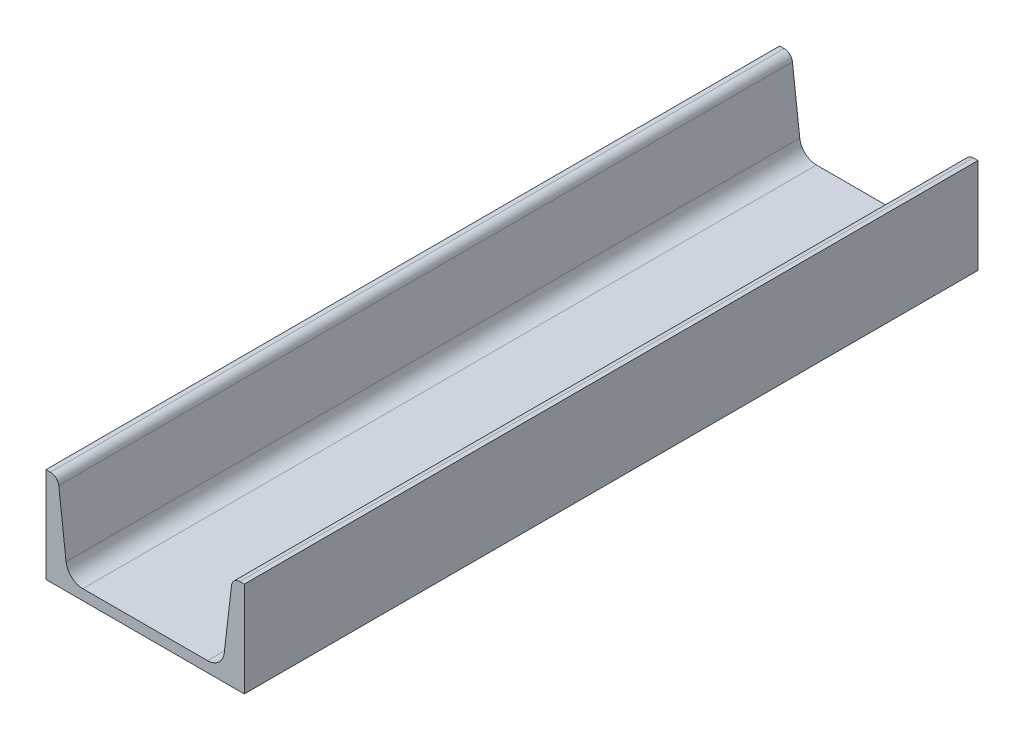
SolidWorks part; units mm, degrees
ref_plane "前视基准面" through (0, 0, 0) normal (0, 0, 1) x (1, 0, 0)
ref_plane "上视基准面" through (0, 0, 0) normal (0, 1, 0) x (1, 0, 0)
ref_plane "右视基准面" through (0, 0, 0) normal (1, 0, 0) x (0, 0, -1)
sketch "草图1" plane through (0, 0, 0) normal (0, 0, 1) x (1, 0, 0)
  line L0 (-50, 0) -> (50, 0)
  line L1 (50, 0) -> (50, 48)
  line L2 (50, 48) -> (47.7369, 48)
  line L3 (43.5654, 44.2885) -> (39.8796, 12.8114)
  line L4 (31.4372, 5.3) -> (-31.4372, 5.3)
  line L5 (-39.8796, 12.8114) -> (-43.5654, 44.2885)
  line L6 (-47.7369, 48) -> (-50, 48)
  line L7 (-50, 48) -> (-50, 0)
  line L8 (-50, 26.65) -> (-41.5, 26.65) construction
  line L9 (41.5, 26.65) -> (50, 26.65) construction
  arc A0 (-31.4372, 5.3) -> (-39.8796, 12.8114) centre (-31.4372, 13.8) cw
  arc A1 (39.8796, 12.8114) -> (31.4372, 5.3) centre (31.4372, 13.8) cw
  arc A2 (-43.5654, 44.2885) -> (-47.7369, 48) centre (-47.7369, 43.8) ccw
  arc A3 (47.7369, 48) -> (43.5654, 44.2885) centre (47.7369, 43.8) ccw
  point P19 (-44, 48)
  point P22 (44, 48)
  dimension "D10" = 8.5
  dimension "D11" = 4.2
  dimension "D1" = 100
  dimension "D2" = 6
  dimension "D3" = 6
  dimension "D4" = 48
  dimension "D5" = 48
  dimension "D6" = 5.3
  dimension "D7" = 21.35
  dimension "D8" = 8.5
  dimension "D9" = 8.5
extrude "拉伸1" add sketch "草图1" along normal mid plane 370
